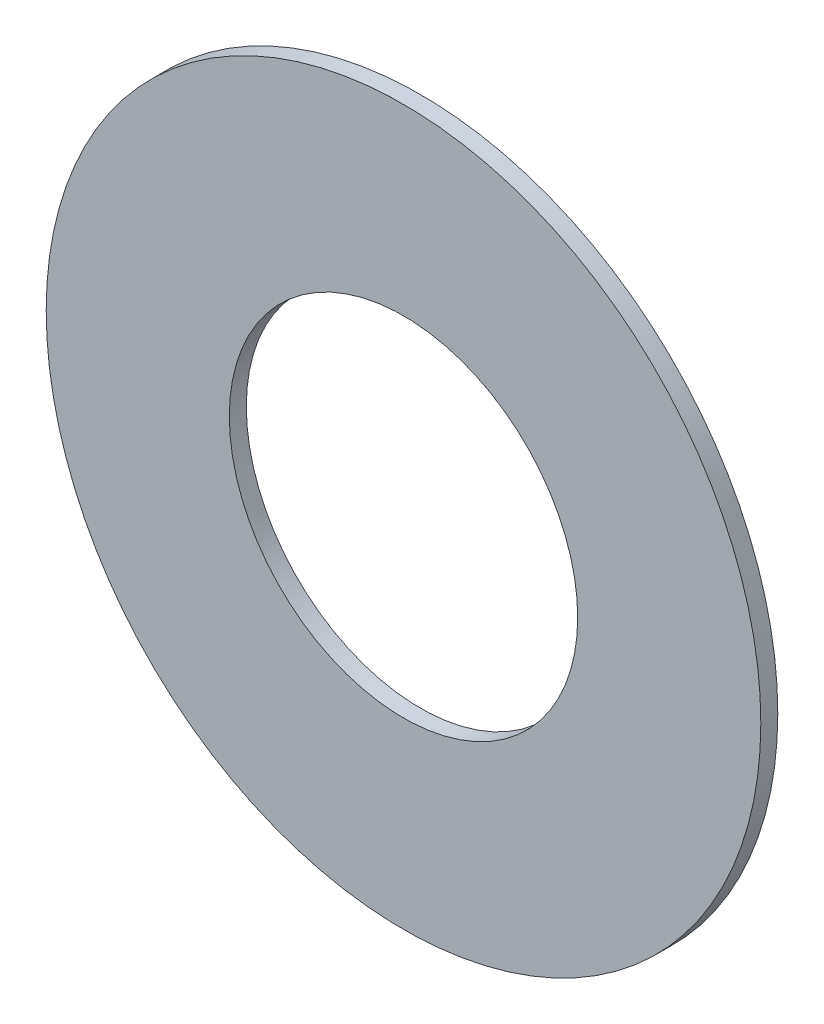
SolidWorks part; units mm, degrees
ref_plane "Front Plane" through (0, 0, 0) normal (0, 0, 1) x (1, 0, 0)
ref_plane "Top Plane" through (0, 0, 0) normal (0, 1, 0) x (1, 0, 0)
ref_plane "Right Plane" through (0, 0, 0) normal (1, 0, 0) x (0, 0, -1)
sketch "Sketch1" plane through (0, 0, 0) normal (0, 0, 1) x (1, 0, 0)
  circle A0 centre (0, 0) radius 50.8
  dimension "D1" = 101.6
extrude "Boss-Extrude1" add sketch "Sketch1" along normal blind 2.413
sketch "Sketch2" plane through (0, 0, 2.413) normal (0, 0, 1) x (1, 0, 0)
  circle A0 centre (0, 0) radius 24.765
  dimension "D1" = 49.53
extrude "Cut-Extrude1" cut sketch "Sketch2" against normal blind 2.413
